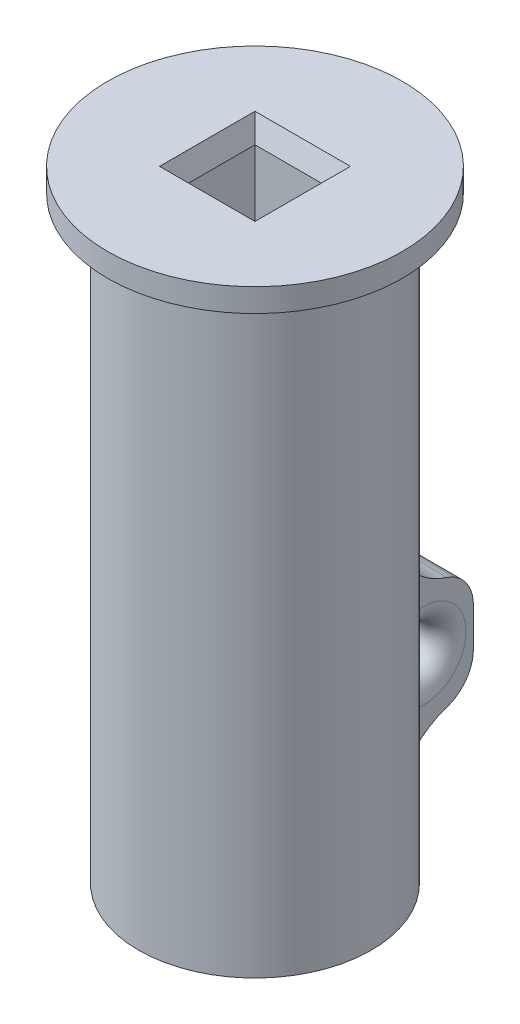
SolidWorks part; units mm, degrees
ref_plane "Спереди" through (0, 0, 0) normal (0, 0, 1) x (1, 0, 0)
ref_plane "Сверху" through (0, 0, 0) normal (0, 1, 0) x (1, 0, 0)
ref_plane "Справа" through (0, 0, 0) normal (1, 0, 0) x (0, 0, -1)
sketch "Эскиз1" plane through (0, 0, 0) normal (0, 1, 0) x (1, 0, 0)
  line L1 (5.15, -5.15) -> (-5.15, -5.15)
  line L2 (5.15, -5.15) -> (5.15, 5.15)
  line L3 (5.15, 5.15) -> (-5.15, 5.15)
  line L4 (-5.15, -5.15) -> (-5.15, 5.15)
  line L5 (5.15, -5.15) -> (-5.15, 5.15) construction
  line L6 (5.15, 5.15) -> (-5.15, -5.15) construction
  circle A0 centre (0, 0) radius 15
  dimension "D1" = 30
  dimension "D2" = 10.3
extrude "Бобышка-Вытянуть1" add sketch "Эскиз1" along normal blind 80
sketch "Sketch1" plane through (0, 80, 0) normal (0, 1, 0) x (1, 0, 0)
  line L1 (5.15, -5.15) -> (-5.15, -5.15)
  line L2 (5.15, -5.15) -> (5.15, 5.15)
  line L3 (5.15, 5.15) -> (-5.15, 5.15)
  line L4 (-5.15, -5.15) -> (-5.15, 5.15)
  line L5 (5.15, -5.15) -> (-5.15, 5.15) construction
  line L6 (5.15, 5.15) -> (-5.15, -5.15) construction
  circle A0 centre (0, 0) radius 19
  dimension "D1" = 38
extrude "Boss-Extrude1" add sketch "Sketch1" against normal blind 3
sketch "Sketch6" plane through (0, 0, -5.15) normal (0, 0, 1) x (1, 0, 0)
  line L0 (0, 0) -> (0, 79.7395) construction
  line L1 (5.15, 0) -> (-5.15, 0) construction
  line L3 (-3, 25) -> (3, 25)
  line L4 (-3, 25) -> (-3, 10)
  line L5 (-3, 10) -> (3, 10)
  line L6 (3, 25) -> (3, 10)
  line L7 (-3, 25) -> (3, 10) construction
  line L8 (-3, 10) -> (3, 25) construction
  point P4 (0, 17.5)
  dimension "D1" = 6
  dimension "D2" = 15
  dimension "D3" = 10
extrude "Boss-Extrude3" add sketch "Sketch6" against normal blind 20
fillet "Fillet1" radius 5 2 edges at (0, 10, -25.15) (0, 25, -25.15)
sketch "Sketch7" plane through (3, 0, 0) normal (1, 0, 0) x (0, 0, -1)
  line L0 (18.6969, 25) -> (18.6969, 10) construction
  line L1 (20.15, 25) -> (14.6969, 25) construction
  line L2 (20.15, 10) -> (14.6969, 10) construction
  line L3 (14.6969, 10) -> (14.6969, 25) construction
  circle A0 centre (18.6969, 17.5) radius 2.5
  dimension "D1" = 5
  dimension "D2" = 4
extrude "Cut-Extrude3" cut sketch "Sketch7" against normal through all
fillet "Fillet2" radius 10 2 edges at (0, 25, -15) (0, 10, -15)
sketch "Sketch8" plane through (3, 0, 0) normal (1, 0, 0) x (0, 0, -1)
  line L0 (14.6969, 0.6431) -> (14.6969, 34.3569) construction
  line L1 (16.6969, 15.6431) -> (14.6969, 15.6431)
  line L2 (16.6969, 15.6431) -> (16.6969, 35.6431)
  line L3 (16.6969, 35.6431) -> (14.6969, 35.6431)
  line L4 (14.6969, 15.6431) -> (14.6969, 35.6431)
  line L5 (16.6969, 15.6431) -> (14.6969, 35.6431) construction
  line L6 (16.6969, 35.6431) -> (14.6969, 15.6431) construction
  point P0 (15.6969, 25.6431)
  dimension "D1" = 2
  dimension "D2" = 15
  dimension "D3" = 20
extrude "Cut-Extrude4" cut sketch "Sketch8" against normal through all
fillet "Fillet3" radius 3 2 edges at (-3, 17.5, -21.1969) (3, 17.5, -21.1969)
fillet "Fillet4" radius 1 2 edges at (-1.9351, 15.6431, -16.0816) (2.248, 15.6431, -15.7143)
fillet "Fillet5" radius 1 1 edges at (0, 15.6431, -14.6969)
chamfer "Chamfer1" distance 1 angle 70 4 edges at (5.15, 80, 0) (0, 80, 5.15) (-5.15, 80, 0) (0, 80, -5.15)
